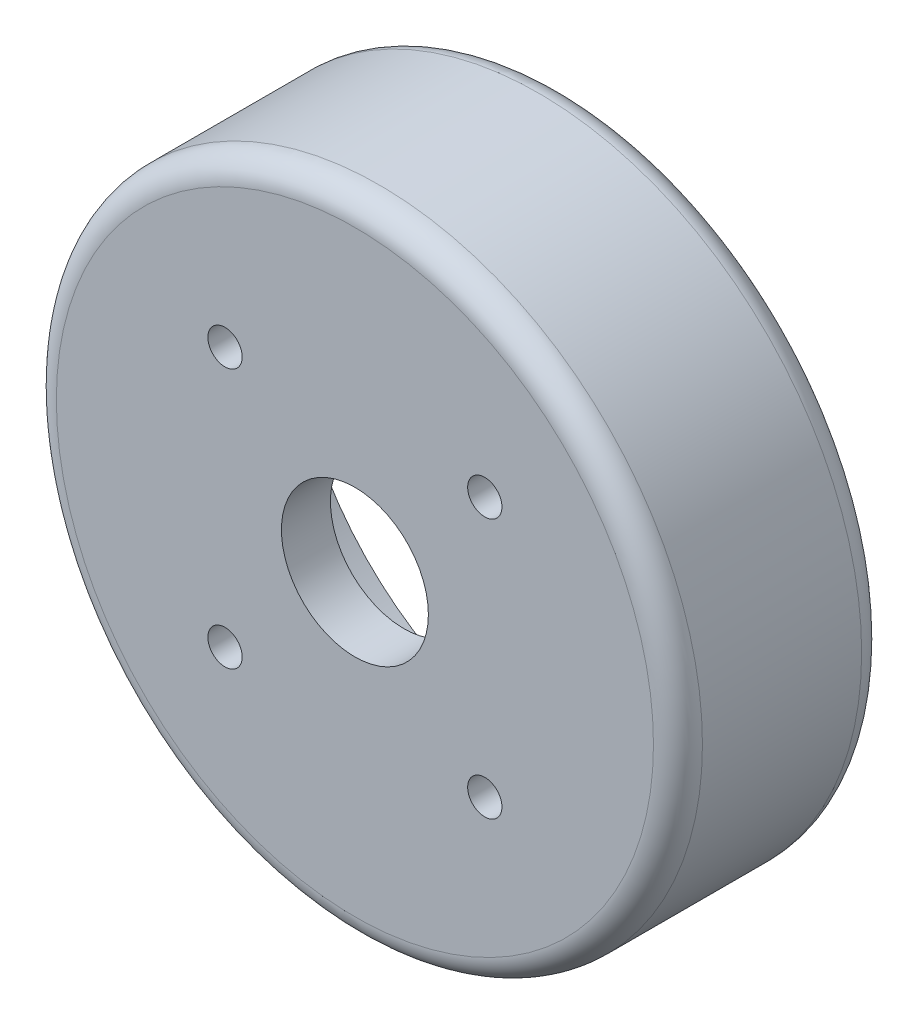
SolidWorks part; units mm, degrees
ref_plane "Front Plane" through (0, 0, 0) normal (0, 0, 1) x (1, 0, 0)
ref_plane "Top Plane" through (0, 0, 0) normal (0, 1, 0) x (1, 0, 0)
ref_plane "Right Plane" through (0, 0, 0) normal (1, 0, 0) x (0, 0, -1)
sketch "Sketch1" plane through (0, 0, 0) normal (0, 0, 1) x (1, 0, 0)
  circle A0 centre (0, 0) radius 28.4226 construction
  circle A1 centre (0, 0) radius 28.4226
  circle A2 centre (0, 0) radius 33.5026
  dimension "D1" = 5.08
extrude "Boss-Extrude1" add sketch "Sketch1" against normal blind 12.7
sketch "Sketch2" plane through (0, 0, 0) normal (0, 0, 1) x (1, 0, 0)
  circle A0 centre (0, 0) radius 33.5026 construction
  circle A1 centre (0, 0) radius 33.5026
  circle A2 centre (0, 0) radius 25.4
  dimension "D1" = 50.8
extrude "Boss-Extrude2" add sketch "Sketch2" along normal blind 3.81
sketch "Sketch3" plane through (0, 0, 3.81) normal (0, 0, 1) x (1, 0, 0)
  circle A0 centre (0, 0) radius 33.5026 construction
  circle A1 centre (0, 0) radius 33.5026
  circle A2 centre (0, 0) radius 7.62
  dimension "D1" = 15.24
extrude "Boss-Extrude3" add sketch "Sketch3" along normal blind 5.08
sketch "Sketch4" plane through (0, 0, 3.81) normal (0, 0, -1) x (-1, 0, 0)
  circle A0 centre (13.4704, -13.4704) radius 1.778 construction
  circle A1 centre (-13.4704, -13.4704) radius 1.778 construction
  circle A2 centre (-13.4704, 13.4704) radius 1.778 construction
  circle A3 centre (13.4704, 13.4704) radius 1.778 construction
  circle A4 centre (13.4704, -13.4704) radius 1.778
  circle A5 centre (-13.4704, -13.4704) radius 1.778
  circle A6 centre (-13.4704, 13.4704) radius 1.778
  circle A7 centre (13.4704, 13.4704) radius 1.778
extrude "Cut-Extrude1" cut sketch "Sketch4" against normal through all
sketch "Sketch5" plane through (0, 0, 3.81) normal (0, 0, -1) x (-1, 0, 0)
  line L0 (0, 0) -> (33.5026, 0) construction
  line L1 (-8.631, 13.4704) -> (-11.0507, 17.6614)
  line L2 (-11.0507, 17.6614) -> (-15.8901, 17.6614)
  line L3 (-15.8901, 17.6614) -> (-18.3097, 13.4704)
  line L4 (-18.3097, 13.4704) -> (-15.8901, 9.2794)
  line L5 (-15.8901, 9.2794) -> (-11.0507, 9.2794)
  line L6 (-11.0507, 9.2794) -> (-8.631, 13.4704)
  line L7 (8.631, 13.4704) -> (11.0507, 9.2794)
  line L8 (11.0507, 9.2794) -> (15.8901, 9.2794)
  line L9 (15.8901, 9.2794) -> (18.3097, 13.4704)
  line L10 (18.3097, 13.4704) -> (15.8901, 17.6614)
  line L11 (15.8901, 17.6614) -> (11.0507, 17.6614)
  line L12 (11.0507, 17.6614) -> (8.631, 13.4704)
  line L13 (8.631, -13.4704) -> (11.0507, -17.6614)
  line L14 (11.0507, -17.6614) -> (15.8901, -17.6614)
  line L15 (15.8901, -17.6614) -> (18.3097, -13.4704)
  line L16 (18.3097, -13.4704) -> (15.8901, -9.2794)
  line L17 (15.8901, -9.2794) -> (11.0507, -9.2794)
  line L18 (11.0507, -9.2794) -> (8.631, -13.4704)
  line L19 (-8.631, -13.4704) -> (-11.0507, -9.2794)
  line L20 (-11.0507, -9.2794) -> (-15.8901, -9.2794)
  line L21 (-15.8901, -9.2794) -> (-18.3097, -13.4704)
  line L22 (-18.3097, -13.4704) -> (-15.8901, -17.6614)
  line L23 (-15.8901, -17.6614) -> (-11.0507, -17.6614)
  line L24 (-11.0507, -17.6614) -> (-8.631, -13.4704)
  line L25 (0, 0) -> (0, 33.5026) construction
  circle A0 centre (-13.4704, 13.4704) radius 4.191 construction
  circle A1 centre (13.4704, 13.4704) radius 4.191 construction
  circle A2 centre (13.4704, -13.4704) radius 4.191 construction
  circle A3 centre (-13.4704, -13.4704) radius 4.191 construction
  circle A4 centre (0, 0) radius 33.5026 construction
  dimension "D1" = 8.382
  dimension "D2" = 26.9408
extrude "Cut-Extrude2" cut sketch "Sketch5" against normal blind 2.54
fillet "Fillet1" radius 2.54 2 edges at (33.5026, 0, -12.7) (33.5026, 0, 8.89)
